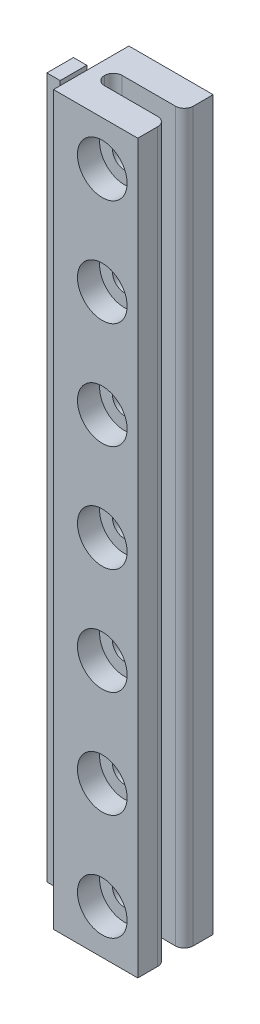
SolidWorks part; units mm, degrees
ref_plane "Front Plane" through (0, 0, 0) normal (0, 0, 1) x (1, 0, 0)
ref_plane "Top Plane" through (0, 0, 0) normal (0, 1, 0) x (1, 0, 0)
ref_plane "Right Plane" through (0, 0, 0) normal (1, 0, 0) x (0, 0, -1)
sketch "Sketch1" plane through (0, 0, 0) normal (0, 0, 1) x (1, 0, 0)
  line L1 (0, 0) -> (13, 0)
  line L2 (0, 0) -> (0, 82)
  line L3 (0, 82) -> (13, 82)
  line L4 (13, 0) -> (13, 82)
  dimension "D1" = 13
  dimension "D2" = 82
extrude "Boss-Extrude1" add sketch "Sketch1" along normal blind 8.5
sketch "Sketch2" plane through (0, 82, 0) normal (0, 1, 0) x (1, 0, 0)
  line L0 (13, -8.5) -> (13, 0) construction
  line L1 (5, -5.25) -> (13, -5.25)
  line L2 (5, -5.25) -> (5, -3.25)
  line L3 (5, -3.25) -> (13, -3.25)
  line L4 (13, -5.25) -> (13, -3.25)
  point P4 (13, -4.25)
  point P7 (13, -4.25)
  dimension "D1" = 2
  dimension "D2" = 8
extrude "Cut-Extrude1" cut sketch "Sketch2" against normal through all
sketch "Sketch6" plane through (0, 0, 0) normal (0, -1, 0) x (1, 0, 0)
  line L0 (0, 4.25) -> (5, 4.25) construction
  line L1 (0, 8.5) -> (0, 0) construction
  line L2 (5, 3.25) -> (5, 5.25) construction
  line L3 (0, 0) -> (0, 2.75)
  line L4 (3.5, 0) -> (0, 0)
  line L5 (0, 5.75) -> (1.5, 5.75)
  line L6 (1.5, 5.75) -> (1.5, 4.95)
  line L7 (3.5, 3.55) -> (3.5, 0)
  line L8 (1.5, 4.95) -> (3.5, 4.95)
  line L9 (3.5, 4.95) -> (3.5, 8.5)
  line L12 (0, 8.5) -> (0, 5.75)
  line L13 (1.5, 3.55) -> (3.5, 3.55)
  line L14 (1.5, 2.75) -> (1.5, 3.55)
  line L15 (0, 2.75) -> (1.5, 2.75)
  line L16 (3.5, 8.5) -> (0, 8.5)
  line L18 (0, 8.5) -> (13, 8.5) construction
  dimension "D2" = 0.8
  dimension "D3" = 2
  dimension "D4" = 1.5
  dimension "D6" = 1.5
extrude "Cut-Extrude3" cut sketch "Sketch6" against normal through all
sketch "Sketch7" plane through (0, 0, 3.55) normal (0, 0, -1) x (-1, 0, 0)
  line L0 (-3.5, 82) -> (-3.5, 0) construction
  line L1 (-1.5, 0) -> (-3.5, 0)
  line L2 (-1.5, 0) -> (-1.5, 3)
  line L3 (-1.5, 3) -> (-3.5, 3)
  line L4 (-3.5, 0) -> (-3.5, 3)
  line L5 (-1.5, 82) -> (-1.5, 0) construction
  line L6 (-3.5, 82) -> (-1.5, 82)
  line L7 (-3.5, 82) -> (-3.5, 79)
  line L8 (-3.5, 79) -> (-1.5, 79)
  line L9 (-1.5, 82) -> (-1.5, 79)
  dimension "D1" = 3
extrude "Cut-Extrude4" cut sketch "Sketch7" against normal through all
sketch "Sketch8" plane through (0, 0, 0) normal (-1, 0, 0) x (0, 0, 1)
  line L0 (2.75, 82) -> (2.75, 0) construction
  line L1 (5.75, 82) -> (2.75, 82)
  line L2 (5.75, 82) -> (5.75, 80.5)
  line L3 (5.75, 80.5) -> (2.75, 80.5)
  line L4 (2.75, 82) -> (2.75, 80.5)
  line L6 (5.75, 0) -> (2.75, 0)
  line L7 (5.75, 0) -> (5.75, 1.5)
  line L8 (5.75, 1.5) -> (2.75, 1.5)
  line L9 (2.75, 0) -> (2.75, 1.5)
  dimension "D1" = 1.5
extrude "Cut-Extrude5" cut sketch "Sketch8" against normal up to next
sketch "Sketch10" plane through (0, 82, 0) normal (0, 1, 0) x (1, 0, 0)
  line L0 (9, -5.25) -> (9, -8.5) construction
  line L1 (5, -5.25) -> (13, -5.25) construction
  line L2 (13, -8.5) -> (3.5, -8.5) construction
sketch "Sketch11" plane through (0, 0, 8.5) normal (0, 0, 1) x (1, 0, 0)
  line L0 (9, 82) -> (9, 0) construction
  line L1 (3.5, 0) -> (13, 0) construction
  circle A0 centre (9, 77) radius 1.35
  dimension "D1" = 5
  dimension "D2" = 2.7
extrude "Cut-Extrude6" cut sketch "Sketch11" against normal through all
pattern_linear "LPattern1" count 7 spacing 12 along (0, -1, 0) of "Cut-Extrude6"
sketch "Sketch12" plane through (0, 0, 8.5) normal (0, 0, 1) x (1, 0, 0)
  circle A0 centre (9, 77) radius 2.8
  dimension "D1" = 5.6
extrude "Cut-Extrude7" cut sketch "Sketch12" against normal blind 2.5
pattern_linear "LPattern2" count 7 spacing 12 along (0, -1, 0) of "Cut-Extrude7"
sketch "Sketch13" plane through (0, 0, 0) normal (0, 0, -1) x (-1, 0, 0)
  line L1 (-5.8534, 77) -> (-7.4267, 79.725)
  line L2 (-7.4267, 79.725) -> (-10.5733, 79.725)
  line L3 (-10.5733, 79.725) -> (-12.1466, 77)
  line L4 (-12.1466, 77) -> (-10.5733, 74.275)
  line L5 (-10.5733, 74.275) -> (-7.4267, 74.275)
  line L6 (-7.4267, 74.275) -> (-5.8534, 77)
  line L7 (-13, 82) -> (-3.5, 82) construction
  circle A0 centre (-9, 77) radius 2.725 construction
  dimension "D1" = 5.45
extrude "Cut-Extrude8" cut sketch "Sketch13" against normal blind 2.5
pattern_linear "LPattern3" count 7 spacing 12 along (0, -1, 0) of "Cut-Extrude8"
fillet "Fillet1" radius 1 4 edges at (13, 41, 3.25) (13, 41, 5.25) (5, 41, 3.25) (5, 41, 5.25)
fillet "Fillet2" radius 0.5 4 edges at (3.5, 3, 4.25) (3.5, 41, 3.55) (3.5, 79, 4.25) (3.5, 41, 4.95)
